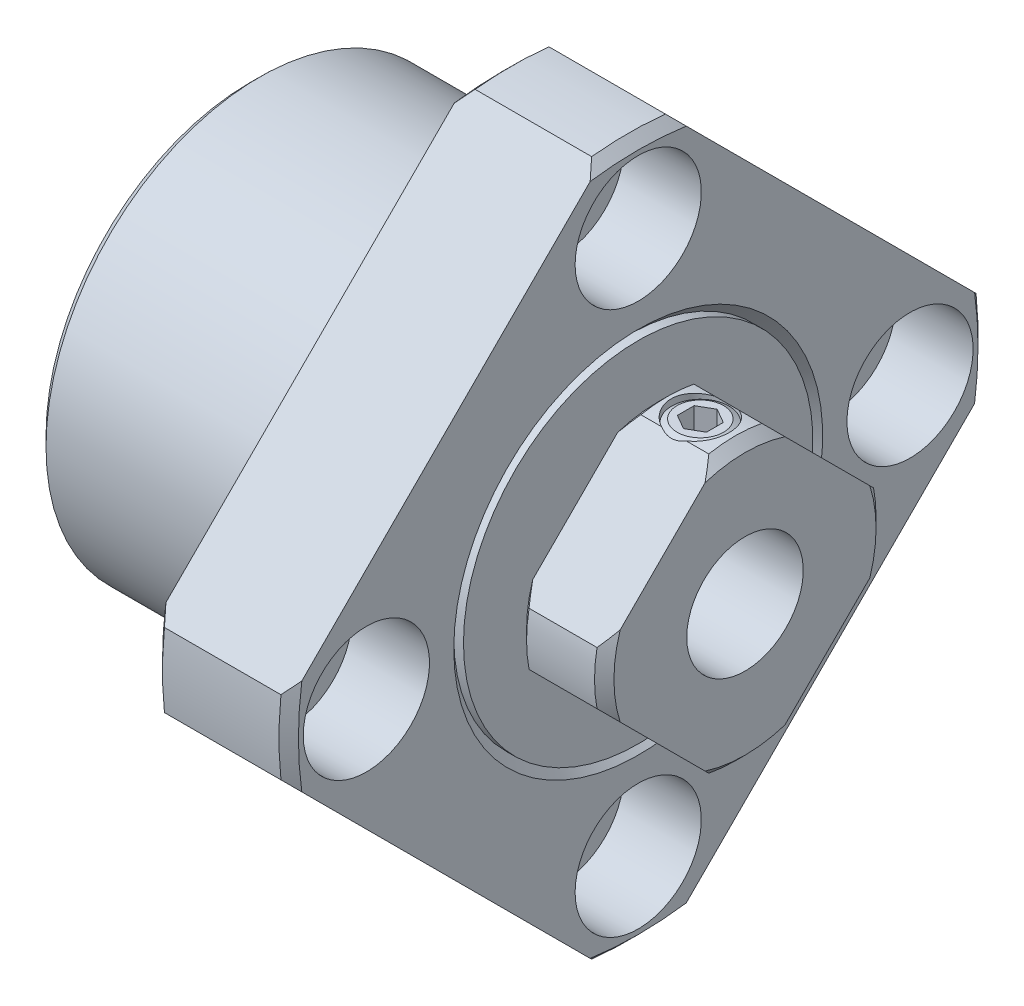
SolidWorks part; units mm, degrees
ref_plane "Front Plane" through (0, 0, 0) normal (0, 0, 1) x (1, 0, 0)
ref_plane "Top Plane" through (0, 0, 0) normal (0, 1, 0) x (1, 0, 0)
ref_plane "Right Plane" through (0, 0, 0) normal (1, 0, 0) x (0, 0, -1)
ref_plane "Plane1" through (0, 0, 0) normal (0, 0, 1) x (1, 0, 0)
sketch "Sketch1" plane through (0, 0, 0) normal (0, 0, 1) x (1, 0, 0)
  line L0 (0, 10.5) -> (0, 9.5)
  line L1 (0, 9.5) -> (0.5, 9)
  line L2 (0.5, 9) -> (0, 9)
  line L3 (0, 9) -> (0, 4.75)
  line L4 (0, 4.75) -> (2.5, 4.75)
  line L5 (2.5, 4.75) -> (3, 3.884)
  line L6 (3, 3.884) -> (3, 3)
  line L7 (3, 3) -> (25.5, 3)
  line L8 (25.5, 3) -> (25.5, 6.75)
  line L9 (25.5, 6.75) -> (25, 7.25)
  line L10 (25, 7.25) -> (21.5, 7.25)
  line L11 (21.5, 7.25) -> (21, 6.75)
  line L12 (21, 6.75) -> (21, 5)
  line L13 (21, 5) -> (20.5, 5)
  line L14 (20.5, 5) -> (20.5, 4.5)
  line L15 (20.5, 4.5) -> (20, 4.5)
  line L16 (20, 4.5) -> (20, 17.5)
  line L17 (20, 17.5) -> (19.5, 18)
  line L18 (19.5, 18) -> (13.5, 18)
  line L19 (13.5, 18) -> (13, 17.5)
  line L20 (13, 17.5) -> (13, 11.22)
  line L21 (12.78, 11) -> (0.5, 11)
  line L22 (0.5, 11) -> (0, 10.5)
  line L23 (25.5, 0) -> (0, 0) construction
  arc A0 (13, 11.22) -> (12.78, 11) centre (12.78, 11.22) cw
revolve "Revolve1" add sketch "Sketch1" angle 360 about L23
ref_plane "Plane2" through (25.5, 0, 0) normal (1, 0, 0) x (0, 0, -1)
sketch "Sketch2" plane through (25.5, 0, 0) normal (1, 0, 0) x (0, 0, -1)
  line L0 (-16.9706, 0) -> (0, -16.9706)
  line L1 (0, -16.9706) -> (16.9706, 0)
  line L2 (16.9706, 0) -> (0, 16.9706)
  line L3 (0, 16.9706) -> (-16.9706, 0)
  line L4 (-8.4853, 0) -> (0, -8.4853)
  line L5 (0, -8.4853) -> (8.4853, 0)
  line L6 (8.4853, 0) -> (0, 8.4853)
  line L7 (0, 8.4853) -> (-8.4853, 0)
extrude "Cut-Extrude1" cut sketch "Sketch2" against normal blind 5
ref_plane "Plane3" through (0, 0, 0) normal (0, 0, 1) x (1, 0, 0)
sketch "Sketch3" plane through (0, 0, 0) normal (0, 0, 1) x (1, 0, 0)
  line L0 (13, 14) -> (13, 15.7)
  line L1 (13, 15.7) -> (16, 15.7)
  line L2 (16, 15.7) -> (16, 17.25)
  line L3 (16, 17.25) -> (20, 17.25)
  line L4 (20, 17.25) -> (20, 14)
  line L5 (20, 14) -> (13, 14)
  line L6 (20, 14) -> (13, 14) construction
revolve "Cut-Revolve1" cut sketch "Sketch3" angle 360 about L6
ref_plane "Plane4" through (0, 0, -14) normal (0, 0, 1) x (1, 0, 0)
sketch "Sketch4" plane through (0, 0, -14) normal (0, 0, 1) x (1, 0, 0)
  line L0 (13, 0) -> (13, 1.7)
  line L1 (13, 1.7) -> (16, 1.7)
  line L2 (16, 1.7) -> (16, 3.25)
  line L3 (16, 3.25) -> (20, 3.25)
  line L4 (20, 3.25) -> (20, 0)
  line L5 (20, 0) -> (13, 0)
  line L6 (20, 0) -> (13, 0) construction
revolve "Cut-Revolve2" cut sketch "Sketch4" angle 360 about L6
ref_plane "Plane5" through (0, 0, 0) normal (0, 0, 1) x (1, 0, 0)
sketch "Sketch5" plane through (0, 0, 0) normal (0, 0, 1) x (1, 0, 0)
  line L0 (13, -14) -> (13, -12.3)
  line L1 (13, -12.3) -> (16, -12.3)
  line L2 (16, -12.3) -> (16, -10.75)
  line L3 (16, -10.75) -> (20, -10.75)
  line L4 (20, -10.75) -> (20, -14)
  line L5 (20, -14) -> (13, -14)
  line L6 (20, -14) -> (13, -14) construction
revolve "Cut-Revolve3" cut sketch "Sketch5" angle 360 about L6
ref_plane "Plane6" through (0, 0, 14) normal (0, 0, 1) x (1, 0, 0)
sketch "Sketch6" plane through (0, 0, 14) normal (0, 0, 1) x (1, 0, 0)
  line L0 (13, 0) -> (13, 1.7)
  line L1 (13, 1.7) -> (16, 1.7)
  line L2 (16, 1.7) -> (16, 3.25)
  line L3 (16, 3.25) -> (20, 3.25)
  line L4 (20, 3.25) -> (20, 0)
  line L5 (20, 0) -> (13, 0)
  line L6 (20, 0) -> (13, 0) construction
revolve "Cut-Revolve4" cut sketch "Sketch6" angle 360 about L6
ref_plane "Plane7" through (0, 0, 0) normal (0, 0, 1) x (1, 0, 0)
sketch "Sketch7" plane through (0, 0, 0) normal (0, 0, 1) x (1, 0, 0)
  line L0 (19.5, 9) -> (20, 9)
  line L1 (20, 9) -> (20, 9.5)
  line L2 (20, 9.5) -> (19.5, 9)
  line L3 (20, 0) -> (19.5, 0) construction
revolve "Cut-Revolve5" cut sketch "Sketch7" angle 360 about L3
ref_plane "Plane8" through (20, 0, 0) normal (1, 0, 0) x (0, 0, -1)
sketch "Sketch8" plane through (20, 0, 0) normal (1, 0, 0) x (0, 0, -1)
  line L0 (-39.598, 0) -> (0, -39.598)
  line L1 (0, -39.598) -> (39.598, 0)
  line L2 (39.598, 0) -> (0, 39.598)
  line L3 (0, 39.598) -> (-39.598, 0)
  line L4 (-19.799, 0) -> (0, -19.799)
  line L5 (0, -19.799) -> (19.799, 0)
  line L6 (19.799, 0) -> (0, 19.799)
  line L7 (0, 19.799) -> (-19.799, 0)
extrude "Cut-Extrude2" cut sketch "Sketch8" against normal blind 7
ref_plane "Plane9" through (0, 0, 0) normal (0, 0, 1) x (1, 0, 0)
sketch "Sketch9" plane through (0, 0, 0) normal (0, 0, 1) x (1, 0, 0)
  line L0 (23.2, 7.25) -> (24.7, 7.25)
  line L1 (24.7, 7.25) -> (24.7, 4.25)
  line L2 (24.7, 4.25) -> (24.67, 4.25)
  line L3 (24.67, 4.25) -> (24.67, 6.9404)
  line L4 (24.67, 6.9404) -> (24.3935, 7.1)
  line L5 (24.3935, 7.1) -> (23.2, 7.1)
  line L6 (23.2, 7.1) -> (23.2, 7.25)
  line L7 (23.2, 7.1) -> (23.2, 7.25) construction
revolve "Cut-Revolve6" cut sketch "Sketch9" angle 360 about L7
ref_plane "Plane10" through (0, 7.1, 0) normal (0, 1, 0) x (1, 0, 0)
sketch "Sketch10" plane through (0, 7.1, 0) normal (0, 1, 0) x (1, 0, 0)
  line L0 (22.45, 0.433) -> (22.45, -0.433)
  line L1 (22.45, -0.433) -> (23.2, -0.866)
  line L2 (23.2, -0.866) -> (23.95, -0.433)
  line L3 (23.95, -0.433) -> (23.95, 0.433)
  line L4 (23.95, 0.433) -> (23.2, 0.866)
  line L5 (23.2, 0.866) -> (22.45, 0.433)
extrude "Cut-Extrude3" cut sketch "Sketch10" against normal blind 1.8
